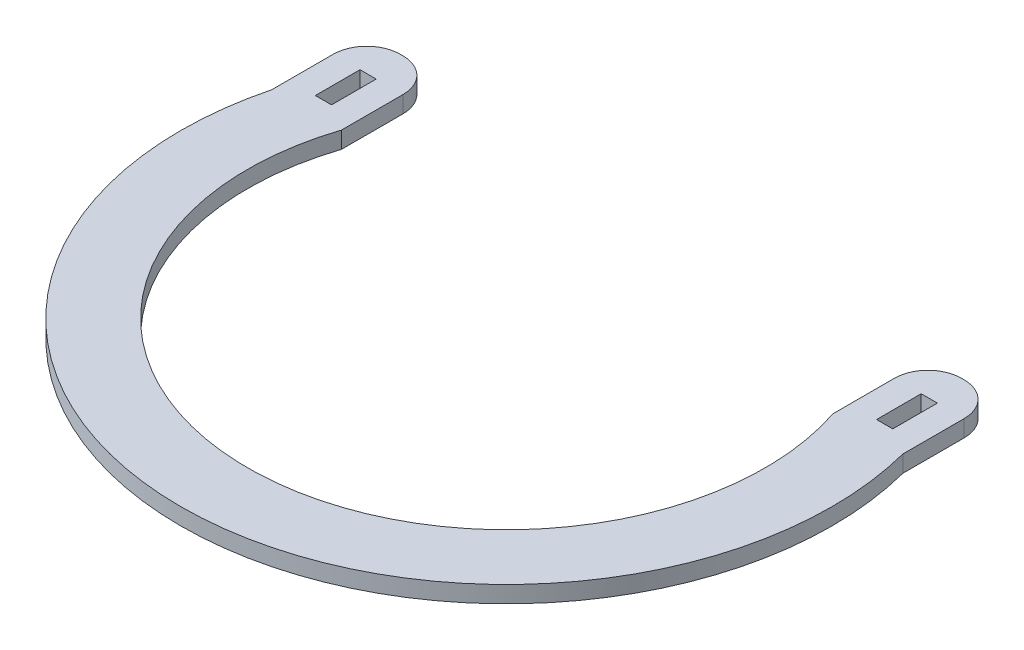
SolidWorks part; units mm, degrees
ref_plane "Plan de face" through (0, 0, 0) normal (0, 0, 1) x (1, 0, 0)
ref_plane "Plan de dessus" through (0, 0, 0) normal (0, 1, 0) x (1, 0, 0)
ref_plane "Plan de droite" through (0, 0, 0) normal (1, 0, 0) x (0, 0, -1)
sketch "Esquisse1" plane through (0, 0, 0) normal (0, 1, 0) x (1, 0, 0)
  line L0 (0, 0) -> (0, -65) construction
  line L1 (0, 0) -> (44, 0) construction
  line L2 (0, 0) -> (-56.4955, 0) construction
  line L3 (44, 0) -> (56.4955, 0) construction
  line L4 (50.4955, 17) -> (50, 17)
  line L6 (-56.4955, 0) -> (-56.4955, 11)
  line L7 (-50.4955, 17) -> (-50, 17)
  line L8 (-44, 0) -> (-44, 11)
  line L9 (44, 0) -> (44, 11)
  line L10 (56.4955, 0) -> (56.4955, 11)
  line L11 (-65.3529, 3) -> (65.9943, 3) construction
  line L12 (-50.2478, 17) -> (-50.2478, -3.6074) construction
  line L13 (51.6978, 3) -> (48.7978, 3)
  line L14 (-51.6978, 11) -> (-48.7978, 11)
  line L15 (-51.6978, 11) -> (-51.6978, 3)
  line L16 (-51.6978, 3) -> (-48.7978, 3)
  line L17 (-48.7978, 11) -> (-48.7978, 3)
  line L18 (-51.6978, 11) -> (-48.7978, 3) construction
  line L19 (-51.6978, 3) -> (-48.7978, 11) construction
  line L20 (51.6978, 11) -> (51.6978, 3)
  line L21 (48.7978, 11) -> (48.7978, 3)
  line L22 (51.6978, 11) -> (48.7978, 11)
  arc A0 (-44, 0) -> (44, 0) centre (0, -14.4841) ccw
  arc A1 (-56.4955, 0) -> (56.4955, 0) centre (0, -14.4841) ccw
  arc A2 (-44, 11) -> (-50, 17) centre (-50, 11) ccw
  arc A3 (-55.3983, 3.7521) -> (55.3983, 3.7521) centre (0, -14.4841) ccw construction
  arc A4 (-56.4955, 11) -> (-50.4955, 17) centre (-50.4955, 11) cw
  arc A5 (56.4955, 11) -> (50.4955, 17) centre (50.4955, 11) ccw
  arc A6 (44, 11) -> (50, 17) centre (50, 11) cw
  point P3 (-44, 0)
  point P5 (44, 0)
  point P19 (-50.2478, 7)
  point P28 (-44, 17)
  point P31 (-56.4955, 17)
  point P34 (56.4955, 17)
  point P37 (44, 17)
  dimension "D9" = 6
  dimension "D10" = 6
  dimension "D1" = 65
  dimension "D2" = 44
  dimension "D4" = 3
  dimension "D5" = 12.4955
  dimension "D6" = 14
  dimension "D7" = 8
  dimension "D8" = 2.9
  dimension "D3" = 12
extrude "Boss.-Extru.1" add sketch "Esquisse1" along normal blind 3
